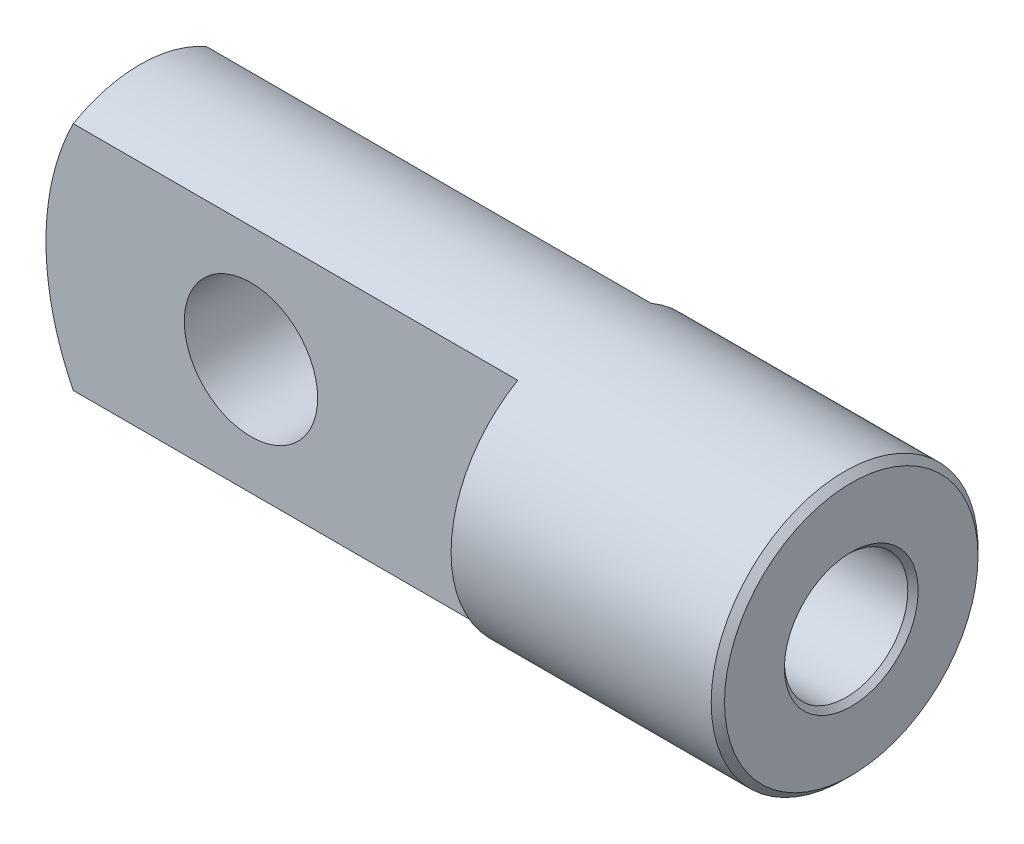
SolidWorks part; units mm, degrees
ref_plane "Спереди" through (0, 0, 0) normal (0, 0, 1) x (1, 0, 0)
ref_plane "Сверху" through (0, 0, 0) normal (0, 1, 0) x (1, 0, 0)
ref_plane "Справа" through (0, 0, 0) normal (1, 0, 0) x (0, 0, -1)
sketch "Эскиз1" plane through (0, 0, 0) normal (0, 0, 1) x (1, 0, 0)
  line L0 (0, 0) -> (0, 19)
  line L1 (0, 0) -> (-112, 0)
  line L2 (-112, 0) -> (5.9349, 0) construction
  line L3 (-1, 20) -> (-106.641, 20)
  line L4 (0, 19) -> (-1, 20)
  arc A0 (-112, 0) -> (-106.641, 20) centre (-72, 0) cw
  point P7 (0, 20)
  dimension "D1" = 112
  dimension "D2" = 20
  dimension "D3" = 40
revolve "Повернуть1" add sketch "Эскиз1" angle 360 about L2
ref_plane "Плоскость2" through (0, 20, 0) normal (0, 1, 0) x (1, 0, 0)
sketch "Эскиз2" plane through (0, 20, 0) normal (0, 1, 0) x (1, 0, 0)
  line L0 (-112, -10) -> (-112, 10)
  line L1 (-112, 10) -> (-40, 10)
  line L2 (-40, 10) -> (-40, 26.1852)
  line L3 (-40, 26.1852) -> (-127.0722, 26.1852)
  line L4 (0, 0) -> (-134.5828, 0) construction
  line L5 (-127.0722, 26.1852) -> (-127.0722, -26.1852)
  line L6 (-112, -10) -> (-40, -10)
  line L7 (-40, -10) -> (-40, -26.1852)
  line L8 (-40, -26.1852) -> (-127.0722, -26.1852)
  arc A0 (-106.641, 20) -> (-106.641, -20) centre (-72, 0) ccw construction
  point P13 (-112, 0)
  point P16 (-127.0722, 0)
  dimension "D1" = 72
  dimension "D2" = 20
extrude "Вырез-Вытянуть1" cut sketch "Эскиз2" against normal blind 50
sketch "Эскиз3" plane through (0, 0, 10) normal (0, 0, 1) x (1, 0, 0)
  line L0 (0, -20) -> (0, 20) construction
  circle A0 centre (-80, 0) radius 10
  dimension "D1" = 20
  dimension "D2" = 80
extrude "Вырез-Вытянуть2" cut sketch "Эскиз3" against normal blind 30
hole_wizard "Отверстие обработанное метчиком M20x1,51" positions "Эскиз5" profile "Эскиз4" tap size "M20x1,5" standard "GOST"
sketch "Эскиз5" plane through (0, 0, 0) normal (1, 0, 0) x (0, 0, -1)
  point P0 (0, 0)
sketch "Эскиз4" plane through (0, 0, 0) normal (0, 1, 0) x (0, 0, -1)
  line L0 (0, 0) -> (0, 41.058)
  line L1 (0, 41.058) -> (9.25, 35.5)
  line L2 (9.25, 35.5) -> (9.25, 0.775)
  line L3 (9.25, 0.775) -> (10.025, 0)
  line L5 (10.025, 0) -> (0, 0)
  line L6 (-9.25, 0.775) -> (-10.025, 0) construction
  line L10 (0, 41.058) -> (-9.25, 35.5) construction
  line L11 (0, -6.35) -> (0, 107.95) construction
  dimension "Диаметр сверла" = 18.5
  dimension "Глубина сверла" = 35.5
  dimension "Диаметр передней зенковки" = 20.05
  dimension "Угол передней зенковки" = 90
  dimension "Угол заточки сверла" = 118
